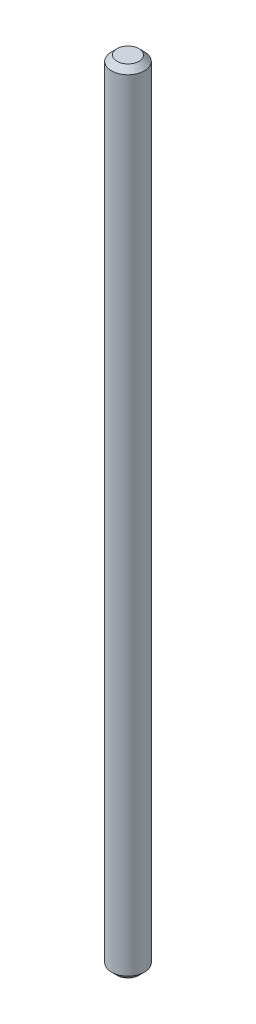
SolidWorks part; units mm, degrees
ref_plane "Front Plane" through (0, 0, 0) normal (0, 0, 1) x (1, 0, 0)
ref_plane "Top Plane" through (0, 0, 0) normal (0, 1, 0) x (1, 0, 0)
ref_plane "Right Plane" through (0, 0, 0) normal (1, 0, 0) x (0, 0, -1)
sketch "Sketch1" plane through (0, 0, 0) normal (0, 1, 0) x (1, 0, 0)
  circle A0 centre (0, 0) radius 1.5
  dimension "D1" = 3
extrude "Extrude1" add sketch "Sketch1" along normal blind 72
chamfer "Chamfer1" distance 0.5 angle 45 2 edges at (0, 0, 1.5) (0, 72, 1.5)
